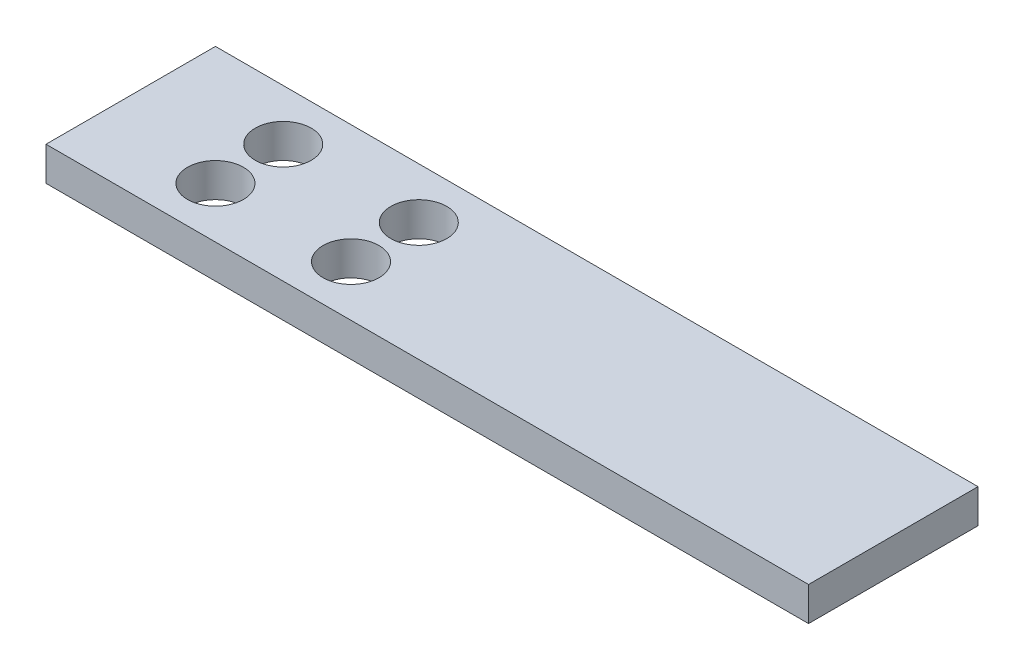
SolidWorks part; units mm, degrees
ref_plane "Front" through (0, 0, 0) normal (0, 0, 1) x (1, 0, 0)
ref_plane "Top" through (0, 0, 0) normal (0, 1, 0) x (1, 0, 0)
ref_plane "Right" through (0, 0, 0) normal (1, 0, 0) x (0, 0, -1)
sketch "草图1" plane through (0, 0, 0) normal (0, 1, 0) x (1, 0, 0)
  line L1 (0, 0) -> (45, 0)
  line L2 (0, 0) -> (0, 10)
  line L3 (0, 10) -> (45, 10)
  line L4 (45, 0) -> (45, 10)
  dimension "D1" = 10
  dimension "D2" = 45
extrude "凸台-拉伸1" add sketch "草图1" along normal blind 2
hole_wizard "Ø3.3 (3.3) 直径孔1" positions "草图2" profile "草图3" hole size "Ø3.3" standard "GB"
sketch "草图2" plane through (0, 2, 0) normal (0, 1, 0) x (1, 0, 0)
  point P0 (7, 3)
  point P3 (7, 7)
  point P6 (15, 3)
  point P9 (15, 7)
sketch "草图3" plane through (7, 2, -3) normal (1, 0, 0) x (0, 0, 1)
  line L0 (0, 0) -> (0, 2)
  line L1 (0, 2) -> (1.65, 2)
  line L2 (1.65, 2) -> (1.65, 0)
  line L5 (1.65, 0) -> (0, 0)
  line L11 (0, -6.35) -> (0, 107.95) construction
  dimension "通孔孔直径" = 3.3
  dimension "通孔孔深度" = 2
